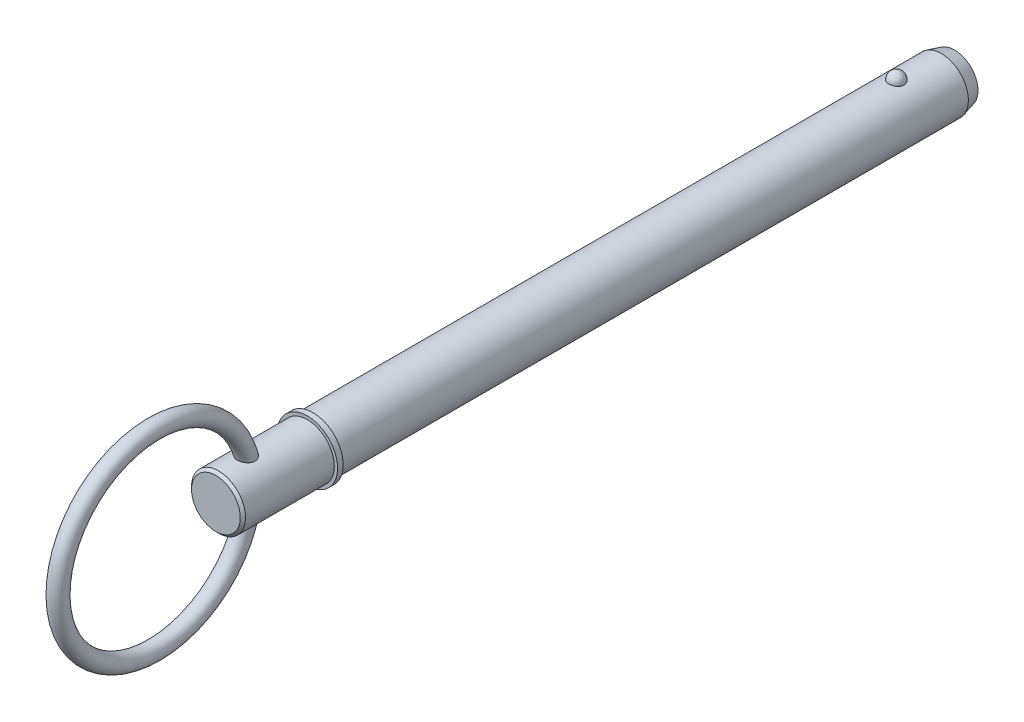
SolidWorks part; units mm, degrees
ref_plane "Front Plane" through (0, 0, 0) normal (0, 0, 1) x (1, 0, 0)
ref_plane "Top Plane" through (0, 0, 0) normal (0, 1, 0) x (1, 0, 0)
ref_plane "Right Plane" through (0, 0, 0) normal (1, 0, 0) x (0, 0, -1)
sketch "Sketch2" plane through (0, 0, 0) normal (0, 0, 1) x (1, 0, 0)
  circle A0 centre (0, 0) radius 7.145
  point P3 (0, 7.145)
  dimension "D1" = 14.29
extrude "Boss-Extrude1" add sketch "Sketch2" along normal blind 152.4
sketch "Sketch3" plane through (0, 0, 0) normal (0, 0, -1) x (-1, 0, 0)
  circle A0 centre (0, 0) radius 7.145
  dimension "D1" = 14.29
extrude "Boss-Extrude2" add sketch "Sketch3" along normal blind 17.45
chamfer "Chamfer1" distance 3.5 angle 15 1 edges at (-7.145, 0, -17.45)
sketch "Sketch18" plane through (0, 0, 0) normal (1, 0, 0) x (0, 0, -1)
  line L0 (13.95, 7.145) -> (-152.4, 7.145) construction
  line L1 (2.02, 9.165) -> (2.02, 5.125)
  line L2 (-152.4, -7.145) -> (13.95, -7.145) construction
  arc A0 (2.02, 9.165) -> (2.02, 5.125) centre (2.02, 7.145) ccw
  point P4 (0, 7.145)
  dimension "D1" = 16.31
revolve "Revolve1" add sketch "Sketch18" angle 360 about L1
sketch "Sketch19" plane through (0, 0, 0) normal (1, 0, 0) x (0, 0, -1)
  line L0 (-33.7288, 0) -> (-46.4542, 0) construction
sketch "Sketch20" plane through (0, 0, 0) normal (1, 0, 0) x (0, 0, -1)
  line L0 (-152.4, 0) -> (-152.4, 8)
  line L1 (-152.4, 7.145) -> (-152.4, -7.145) construction
  line L2 (-152.4, 8) -> (-153.9, 8)
  line L3 (-153.9, 8) -> (-153.9, 0)
  line L4 (-33.7288, 0) -> (-46.4542, 0) construction
  line L5 (-153.9, 0) -> (-152.4, 0)
  dimension "D1" = 8
  dimension "D2" = 1.5
revolve "Revolve2" add sketch "Sketch20" angle 360 about L0
sketch "Sketch21" plane through (0, 0, 152.4) normal (0, 0, -1) x (-1, 0, 0)
  circle A0 centre (0, 0) radius 7.145
  dimension "D1" = 14.29
extrude "Boss-Extrude3" add sketch "Sketch21" against normal blind 25.7
chamfer "Chamfer2" distance 0.7 angle 45 1 edges at (-7.145, 0, 178.1)
sketch "Sketch23" plane through (0, 0, 0) normal (1, 0, 0) x (0, 0, -1)
  line L0 (-178.1, 6.445) -> (-178.1, -6.445) construction
  circle A0 centre (-194.5, 0) radius 25.4
  point P2 (-169.1, 0)
  dimension "D1" = 50.8
  dimension "D2" = 9
sketch "Sketch24" plane through (0, 0, 0) normal (0, 1, 0) x (1, 0, 0)
  circle A0 centre (0, -169.1) radius 2.25
  dimension "D1" = 4.5
sweep "Sweep1" add profiles "Sketch24" path "Sketch23"
